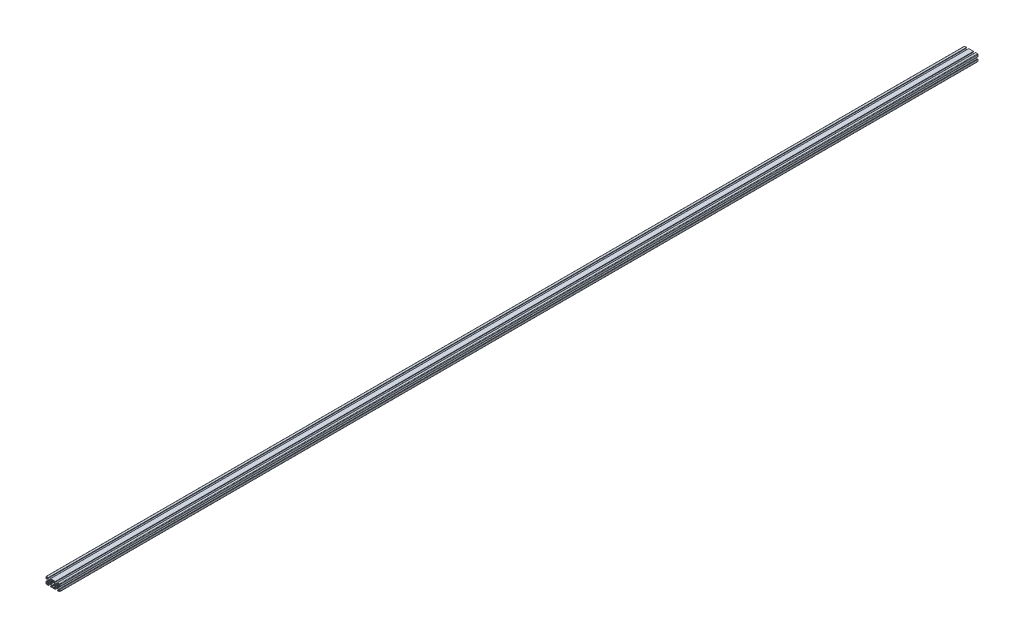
SolidWorks part; units mm, degrees
ref_plane "Front Plane" through (0, 0, 0) normal (0, 0, 1) x (1, 0, 0)
ref_plane "Top Plane" through (0, 0, 0) normal (0, 1, 0) x (1, 0, 0)
ref_plane "Right Plane" through (0, 0, 0) normal (1, 0, 0) x (0, 0, -1)
sketch "Sketch1" plane through (0, 0, 0) normal (0, 0, 1) x (1, 0, 0)
  line L0 (12.7825, 3.7261) -> (13.5257, 2.983)
  line L1 (16.4743, 2.983) -> (17.2175, 3.7261)
  line L2 (18.7261, 2.2175) -> (17.983, 1.4743)
  line L3 (17.983, -1.4743) -> (18.7261, -2.2175)
  line L4 (17.2175, -3.7261) -> (16.4743, -2.983)
  line L5 (13.5257, -2.983) -> (12.7825, -3.7261)
  line L6 (11.2739, -2.2175) -> (12.017, -1.4743)
  line L7 (12.017, 1.4743) -> (11.2739, 2.2175)
  line L8 (-28.7046, 9.8946) -> (-28.7046, 12.6886)
  line L9 (-27.6886, 13.7046) -> (-24.8946, 13.7046)
  line L10 (-24.5136, 13.3236) -> (-24.5136, 9.8946)
  line L11 (-24.8946, 9.5136) -> (-28.3236, 9.5136)
  line L12 (-24.8946, -13.7046) -> (-27.6886, -13.7046)
  line L13 (-28.7046, -12.6886) -> (-28.7046, -9.8946)
  line L14 (-28.3236, -9.5136) -> (-24.8946, -9.5136)
  line L15 (-24.5136, -9.8946) -> (-24.5136, -13.3236)
  line L16 (4.9816, 8.2224) -> (9.0292, 4.1748)
  line L17 (9.178, 3.8155) -> (9.178, 0.9525)
  line L18 (9.178, 0.9525) -> (9.686, 0)
  line L19 (9.686, 0) -> (9.178, -0.9525)
  line L20 (9.178, -0.9525) -> (9.178, -3.8155)
  line L21 (9.0292, -4.1748) -> (4.9816, -8.2224)
  line L22 (4.5352, -9.3) -> (4.5352, -12.4092)
  line L23 (4.1542, -12.7902) -> (-4.1542, -12.7902)
  line L24 (-4.5352, -12.4092) -> (-4.5352, -9.3)
  line L25 (-4.9816, -8.2224) -> (-9.0292, -4.1748)
  line L26 (-9.178, -3.8155) -> (-9.178, -0.9525)
  line L27 (-9.178, -0.9525) -> (-9.686, 0)
  line L28 (-9.686, 0) -> (-9.178, 0.9525)
  line L29 (-9.178, 0.9525) -> (-9.178, 3.8155)
  line L30 (-9.0292, 4.1748) -> (-4.9816, 8.2224)
  line L31 (-4.5352, 9.3) -> (-4.5352, 12.4092)
  line L32 (-4.1542, 12.7902) -> (4.1542, 12.7902)
  line L33 (4.5352, 12.4092) -> (4.5352, 9.3)
  line L34 (-18.7261, -2.2175) -> (-17.983, -1.4743)
  line L35 (-17.983, 1.4743) -> (-18.7261, 2.2175)
  line L36 (-17.2175, 3.7261) -> (-16.4743, 2.983)
  line L37 (-13.5257, 2.983) -> (-12.7825, 3.7261)
  line L38 (-11.2739, 2.2175) -> (-12.017, 1.4743)
  line L39 (-12.017, -1.4743) -> (-11.2739, -2.2175)
  line L40 (-12.7825, -3.7261) -> (-13.5257, -2.983)
  line L41 (-16.4743, -2.983) -> (-17.2175, -3.7261)
  line L42 (24.8946, 13.7046) -> (27.6886, 13.7046)
  line L43 (28.7046, 12.6886) -> (28.7046, 9.8946)
  line L44 (28.3236, 9.5136) -> (24.8946, 9.5136)
  line L45 (24.5136, 9.8946) -> (24.5136, 13.3236)
  line L46 (24.5136, -13.3236) -> (24.5136, -9.8946)
  line L47 (24.8946, -9.5136) -> (28.3236, -9.5136)
  line L48 (28.7046, -9.8946) -> (28.7046, -12.6886)
  line L49 (27.6886, -13.7046) -> (24.8946, -13.7046)
  line L50 (-10.428, -15) -> (10.428, -15)
  line L51 (10.936, -14.492) -> (10.936, -13.2982)
  line L52 (10.428, -12.7902) -> (7.253, -12.7902)
  line L53 (6.745, -12.2822) -> (6.745, -10.2615)
  line L54 (6.8938, -9.9023) -> (10.8252, -5.9708)
  line L55 (11.1845, -5.822) -> (14.0475, -5.822)
  line L56 (14.0475, -5.822) -> (15, -5.314)
  line L57 (15, -5.314) -> (15.9525, -5.822)
  line L58 (15.9525, -5.822) -> (18.8155, -5.822)
  line L59 (19.1748, -5.9708) -> (23.1062, -9.9023)
  line L60 (23.255, -10.2615) -> (23.255, -12.2822)
  line L61 (22.747, -12.7902) -> (19.572, -12.7902)
  line L62 (19.064, -13.2982) -> (19.064, -14.492)
  line L63 (19.572, -15) -> (27.9934, -15)
  line L64 (30, -12.9934) -> (30, -4.572)
  line L65 (29.492, -4.064) -> (28.2982, -4.064)
  line L66 (27.7902, -4.572) -> (27.7902, -7.747)
  line L67 (27.2822, -8.255) -> (25.2615, -8.255)
  line L68 (24.9023, -8.1062) -> (20.9708, -4.1748)
  line L69 (20.822, -3.8155) -> (20.822, -0.9525)
  line L70 (20.822, -0.9525) -> (20.314, 0)
  line L71 (20.314, 0) -> (20.822, 0.9525)
  line L72 (20.822, 0.9525) -> (20.822, 3.8155)
  line L73 (20.9708, 4.1748) -> (24.9023, 8.1062)
  line L74 (25.2615, 8.255) -> (27.2822, 8.255)
  line L75 (27.7902, 7.747) -> (27.7902, 4.572)
  line L76 (28.2982, 4.064) -> (29.492, 4.064)
  line L77 (30, 4.572) -> (30, 12.9934)
  line L78 (27.9934, 15) -> (19.572, 15)
  line L79 (19.064, 14.492) -> (19.064, 13.2982)
  line L80 (19.572, 12.7902) -> (22.747, 12.7902)
  line L81 (23.255, 12.2822) -> (23.255, 10.2615)
  line L82 (23.1062, 9.9023) -> (19.1748, 5.9708)
  line L83 (18.8155, 5.822) -> (15.9525, 5.822)
  line L84 (15.9525, 5.822) -> (15, 5.314)
  line L85 (15, 5.314) -> (14.0475, 5.822)
  line L86 (14.0475, 5.822) -> (11.1845, 5.822)
  line L87 (10.8252, 5.9708) -> (6.8938, 9.9023)
  line L88 (6.745, 10.2615) -> (6.745, 12.2822)
  line L89 (7.253, 12.7902) -> (10.428, 12.7902)
  line L90 (10.936, 13.2982) -> (10.936, 14.492)
  line L91 (10.428, 15) -> (-10.428, 15)
  line L92 (-10.936, 14.492) -> (-10.936, 13.2982)
  line L93 (-10.428, 12.7902) -> (-7.253, 12.7902)
  line L94 (-6.745, 12.2822) -> (-6.745, 10.2615)
  line L95 (-6.8938, 9.9023) -> (-10.8252, 5.9708)
  line L96 (-11.1845, 5.822) -> (-14.0475, 5.822)
  line L97 (-14.0475, 5.822) -> (-15, 5.314)
  line L98 (-15, 5.314) -> (-15.9525, 5.822)
  line L99 (-15.9525, 5.822) -> (-18.8155, 5.822)
  line L100 (-19.1748, 5.9708) -> (-23.1062, 9.9023)
  line L101 (-23.255, 10.2615) -> (-23.255, 12.2822)
  line L102 (-22.747, 12.7902) -> (-19.572, 12.7902)
  line L103 (-19.064, 13.2982) -> (-19.064, 14.492)
  line L104 (-19.572, 15) -> (-27.9934, 15)
  line L105 (-30, 12.9934) -> (-30, 4.572)
  line L106 (-29.492, 4.064) -> (-28.2982, 4.064)
  line L107 (-27.7902, 4.572) -> (-27.7902, 7.747)
  line L108 (-27.2822, 8.255) -> (-25.2615, 8.255)
  line L109 (-24.9023, 8.1062) -> (-20.9708, 4.1748)
  line L110 (-20.822, 3.8155) -> (-20.822, 0.9525)
  line L111 (-20.822, 0.9525) -> (-20.314, 0)
  line L112 (-20.314, 0) -> (-20.822, -0.9525)
  line L113 (-20.822, -0.9525) -> (-20.822, -3.8155)
  line L114 (-20.9708, -4.1748) -> (-24.9023, -8.1062)
  line L115 (-25.2615, -8.255) -> (-27.2822, -8.255)
  line L116 (-27.7902, -7.747) -> (-27.7902, -4.572)
  line L117 (-28.2982, -4.064) -> (-29.492, -4.064)
  line L118 (-30, -4.572) -> (-30, -12.9934)
  line L119 (-27.9934, -15) -> (-19.572, -15)
  line L120 (-19.064, -14.492) -> (-19.064, -13.2982)
  line L121 (-19.572, -12.7902) -> (-22.747, -12.7902)
  line L122 (-23.255, -12.2822) -> (-23.255, -10.2615)
  line L123 (-23.1062, -9.9023) -> (-19.1748, -5.9708)
  line L124 (-18.8155, -5.822) -> (-15.9525, -5.822)
  line L125 (-15.9525, -5.822) -> (-15, -5.314)
  line L126 (-15, -5.314) -> (-14.0475, -5.822)
  line L127 (-14.0475, -5.822) -> (-11.1845, -5.822)
  line L128 (-10.8252, -5.9708) -> (-6.8938, -9.9023)
  line L129 (-6.745, -10.2615) -> (-6.745, -12.2822)
  line L130 (-7.253, -12.7902) -> (-10.428, -12.7902)
  line L131 (-10.936, -13.2982) -> (-10.936, -14.492)
  arc A0 (12.7825, 3.7261) -> (11.2739, 2.2175) centre (12.0282, 2.9718) ccw
  arc A1 (16.4743, 2.983) -> (13.5257, 2.983) centre (15, 0) ccw
  arc A2 (18.7261, 2.2175) -> (17.2175, 3.7261) centre (17.9718, 2.9718) ccw
  arc A3 (17.983, -1.4743) -> (17.983, 1.4743) centre (15, 0) ccw
  arc A4 (17.2175, -3.7261) -> (18.7261, -2.2175) centre (17.9718, -2.9718) ccw
  arc A5 (13.5257, -2.983) -> (16.4743, -2.983) centre (15, 0) ccw
  arc A6 (11.2739, -2.2175) -> (12.7825, -3.7261) centre (12.0282, -2.9718) ccw
  arc A7 (12.017, 1.4743) -> (12.017, -1.4743) centre (15, 0) ccw
  arc A8 (-28.7046, 9.8946) -> (-28.3236, 9.5136) centre (-28.3236, 9.8946) ccw
  arc A9 (-27.6886, 13.7046) -> (-28.7046, 12.6886) centre (-27.6886, 12.6886) ccw
  arc A10 (-24.5136, 13.3236) -> (-24.8946, 13.7046) centre (-24.8946, 13.3236) ccw
  arc A11 (-24.8946, 9.5136) -> (-24.5136, 9.8946) centre (-24.8946, 9.8946) ccw
  arc A12 (-24.8946, -13.7046) -> (-24.5136, -13.3236) centre (-24.8946, -13.3236) ccw
  arc A13 (-28.7046, -12.6886) -> (-27.6886, -13.7046) centre (-27.6886, -12.6886) ccw
  arc A14 (-28.3236, -9.5136) -> (-28.7046, -9.8946) centre (-28.3236, -9.8946) ccw
  arc A15 (-24.5136, -9.8946) -> (-24.8946, -9.5136) centre (-24.8946, -9.8946) ccw
  arc A16 (4.5352, 9.3) -> (4.9816, 8.2224) centre (6.0592, 9.3) ccw
  arc A17 (9.178, 3.8155) -> (9.0292, 4.1748) centre (8.67, 3.8155) ccw
  arc A18 (9.0292, -4.1748) -> (9.178, -3.8155) centre (8.67, -3.8155) ccw
  arc A19 (4.9816, -8.2224) -> (4.5352, -9.3) centre (6.0592, -9.3) ccw
  arc A20 (4.1542, -12.7902) -> (4.5352, -12.4092) centre (4.1542, -12.4092) ccw
  arc A21 (-4.5352, -12.4092) -> (-4.1542, -12.7902) centre (-4.1542, -12.4092) ccw
  arc A22 (-4.5352, -9.3) -> (-4.9816, -8.2224) centre (-6.0592, -9.3) ccw
  arc A23 (-9.178, -3.8155) -> (-9.0292, -4.1748) centre (-8.67, -3.8155) ccw
  arc A24 (-9.0292, 4.1748) -> (-9.178, 3.8155) centre (-8.67, 3.8155) ccw
  arc A25 (-4.9816, 8.2224) -> (-4.5352, 9.3) centre (-6.0592, 9.3) ccw
  arc A26 (-4.1542, 12.7902) -> (-4.5352, 12.4092) centre (-4.1542, 12.4092) ccw
  arc A27 (4.5352, 12.4092) -> (4.1542, 12.7902) centre (4.1542, 12.4092) ccw
  arc A28 (-18.7261, -2.2175) -> (-17.2175, -3.7261) centre (-17.9718, -2.9718) ccw
  arc A29 (-17.983, 1.4743) -> (-17.983, -1.4743) centre (-15, 0) ccw
  arc A30 (-17.2175, 3.7261) -> (-18.7261, 2.2175) centre (-17.9718, 2.9718) ccw
  arc A31 (-13.5257, 2.983) -> (-16.4743, 2.983) centre (-15, 0) ccw
  arc A32 (-11.2739, 2.2175) -> (-12.7825, 3.7261) centre (-12.0282, 2.9718) ccw
  arc A33 (-12.017, -1.4743) -> (-12.017, 1.4743) centre (-15, 0) ccw
  arc A34 (-12.7825, -3.7261) -> (-11.2739, -2.2175) centre (-12.0282, -2.9718) ccw
  arc A35 (-16.4743, -2.983) -> (-13.5257, -2.983) centre (-15, 0) ccw
  arc A36 (24.8946, 13.7046) -> (24.5136, 13.3236) centre (24.8946, 13.3236) ccw
  arc A37 (28.7046, 12.6886) -> (27.6886, 13.7046) centre (27.6886, 12.6886) ccw
  arc A38 (28.3236, 9.5136) -> (28.7046, 9.8946) centre (28.3236, 9.8946) ccw
  arc A39 (24.5136, 9.8946) -> (24.8946, 9.5136) centre (24.8946, 9.8946) ccw
  arc A40 (24.5136, -13.3236) -> (24.8946, -13.7046) centre (24.8946, -13.3236) ccw
  arc A41 (24.8946, -9.5136) -> (24.5136, -9.8946) centre (24.8946, -9.8946) ccw
  arc A42 (28.7046, -9.8946) -> (28.3236, -9.5136) centre (28.3236, -9.8946) ccw
  arc A43 (27.6886, -13.7046) -> (28.7046, -12.6886) centre (27.6886, -12.6886) ccw
  arc A44 (10.428, -15) -> (10.936, -14.492) centre (10.428, -14.492) ccw
  arc A45 (10.936, -13.2982) -> (10.428, -12.7902) centre (10.428, -13.2982) ccw
  arc A46 (6.745, -12.2822) -> (7.253, -12.7902) centre (7.253, -12.2822) ccw
  arc A47 (6.8938, -9.9023) -> (6.745, -10.2615) centre (7.253, -10.2615) ccw
  arc A48 (11.1845, -5.822) -> (10.8252, -5.9708) centre (11.1845, -6.33) ccw
  arc A49 (19.1748, -5.9708) -> (18.8155, -5.822) centre (18.8155, -6.33) ccw
  arc A50 (23.255, -10.2615) -> (23.1062, -9.9023) centre (22.747, -10.2615) ccw
  arc A51 (22.747, -12.7902) -> (23.255, -12.2822) centre (22.747, -12.2822) ccw
  arc A52 (19.572, -12.7902) -> (19.064, -13.2982) centre (19.572, -13.2982) ccw
  arc A53 (19.064, -14.492) -> (19.572, -15) centre (19.572, -14.492) ccw
  arc A54 (27.9934, -15) -> (30, -12.9934) centre (27.9934, -12.9934) ccw
  arc A55 (30, -4.572) -> (29.492, -4.064) centre (29.492, -4.572) ccw
  arc A56 (28.2982, -4.064) -> (27.7902, -4.572) centre (28.2982, -4.572) ccw
  arc A57 (27.2822, -8.255) -> (27.7902, -7.747) centre (27.2822, -7.747) ccw
  arc A58 (24.9023, -8.1062) -> (25.2615, -8.255) centre (25.2615, -7.747) ccw
  arc A59 (20.822, -3.8155) -> (20.9708, -4.1748) centre (21.33, -3.8155) ccw
  arc A60 (20.9708, 4.1748) -> (20.822, 3.8155) centre (21.33, 3.8155) ccw
  arc A61 (25.2615, 8.255) -> (24.9023, 8.1062) centre (25.2615, 7.747) ccw
  arc A62 (27.7902, 7.747) -> (27.2822, 8.255) centre (27.2822, 7.747) ccw
  arc A63 (27.7902, 4.572) -> (28.2982, 4.064) centre (28.2982, 4.572) ccw
  arc A64 (29.492, 4.064) -> (30, 4.572) centre (29.492, 4.572) ccw
  arc A65 (30, 12.9934) -> (27.9934, 15) centre (27.9934, 12.9934) ccw
  arc A66 (19.572, 15) -> (19.064, 14.492) centre (19.572, 14.492) ccw
  arc A67 (19.064, 13.2982) -> (19.572, 12.7902) centre (19.572, 13.2982) ccw
  arc A68 (23.255, 12.2822) -> (22.747, 12.7902) centre (22.747, 12.2822) ccw
  arc A69 (23.1062, 9.9023) -> (23.255, 10.2615) centre (22.747, 10.2615) ccw
  arc A70 (18.8155, 5.822) -> (19.1748, 5.9708) centre (18.8155, 6.33) ccw
  arc A71 (10.8252, 5.9708) -> (11.1845, 5.822) centre (11.1845, 6.33) ccw
  arc A72 (6.745, 10.2615) -> (6.8938, 9.9023) centre (7.253, 10.2615) ccw
  arc A73 (7.253, 12.7902) -> (6.745, 12.2822) centre (7.253, 12.2822) ccw
  arc A74 (10.428, 12.7902) -> (10.936, 13.2982) centre (10.428, 13.2982) ccw
  arc A75 (10.936, 14.492) -> (10.428, 15) centre (10.428, 14.492) ccw
  arc A76 (-10.428, 15) -> (-10.936, 14.492) centre (-10.428, 14.492) ccw
  arc A77 (-10.936, 13.2982) -> (-10.428, 12.7902) centre (-10.428, 13.2982) ccw
  arc A78 (-6.745, 12.2822) -> (-7.253, 12.7902) centre (-7.253, 12.2822) ccw
  arc A79 (-6.8938, 9.9023) -> (-6.745, 10.2615) centre (-7.253, 10.2615) ccw
  arc A80 (-11.1845, 5.822) -> (-10.8252, 5.9708) centre (-11.1845, 6.33) ccw
  arc A81 (-19.1748, 5.9708) -> (-18.8155, 5.822) centre (-18.8155, 6.33) ccw
  arc A82 (-23.255, 10.2615) -> (-23.1062, 9.9023) centre (-22.747, 10.2615) ccw
  arc A83 (-22.747, 12.7902) -> (-23.255, 12.2822) centre (-22.747, 12.2822) ccw
  arc A84 (-19.572, 12.7902) -> (-19.064, 13.2982) centre (-19.572, 13.2982) ccw
  arc A85 (-19.064, 14.492) -> (-19.572, 15) centre (-19.572, 14.492) ccw
  arc A86 (-27.9934, 15) -> (-30, 12.9934) centre (-27.9934, 12.9934) ccw
  arc A87 (-30, 4.572) -> (-29.492, 4.064) centre (-29.492, 4.572) ccw
  arc A88 (-28.2982, 4.064) -> (-27.7902, 4.572) centre (-28.2982, 4.572) ccw
  arc A89 (-27.2822, 8.255) -> (-27.7902, 7.747) centre (-27.2822, 7.747) ccw
  arc A90 (-24.9023, 8.1062) -> (-25.2615, 8.255) centre (-25.2615, 7.747) ccw
  arc A91 (-20.822, 3.8155) -> (-20.9708, 4.1748) centre (-21.33, 3.8155) ccw
  arc A92 (-20.9708, -4.1748) -> (-20.822, -3.8155) centre (-21.33, -3.8155) ccw
  arc A93 (-25.2615, -8.255) -> (-24.9023, -8.1062) centre (-25.2615, -7.747) ccw
  arc A94 (-27.7902, -7.747) -> (-27.2822, -8.255) centre (-27.2822, -7.747) ccw
  arc A95 (-27.7902, -4.572) -> (-28.2982, -4.064) centre (-28.2982, -4.572) ccw
  arc A96 (-29.492, -4.064) -> (-30, -4.572) centre (-29.492, -4.572) ccw
  arc A97 (-30, -12.9934) -> (-27.9934, -15) centre (-27.9934, -12.9934) ccw
  arc A98 (-19.572, -15) -> (-19.064, -14.492) centre (-19.572, -14.492) ccw
  arc A99 (-19.064, -13.2982) -> (-19.572, -12.7902) centre (-19.572, -13.2982) ccw
  arc A100 (-23.255, -12.2822) -> (-22.747, -12.7902) centre (-22.747, -12.2822) ccw
  arc A101 (-23.1062, -9.9023) -> (-23.255, -10.2615) centre (-22.747, -10.2615) ccw
  arc A102 (-18.8155, -5.822) -> (-19.1748, -5.9708) centre (-18.8155, -6.33) ccw
  arc A103 (-10.8252, -5.9708) -> (-11.1845, -5.822) centre (-11.1845, -6.33) ccw
  arc A104 (-6.745, -10.2615) -> (-6.8938, -9.9023) centre (-7.253, -10.2615) ccw
  arc A105 (-7.253, -12.7902) -> (-6.745, -12.2822) centre (-7.253, -12.2822) ccw
  arc A106 (-10.428, -12.7902) -> (-10.936, -13.2982) centre (-10.428, -13.2982) ccw
  arc A107 (-10.936, -14.492) -> (-10.428, -15) centre (-10.428, -14.492) ccw
extrude "Extrude1" add sketch "Sketch1" against normal blind 4000
